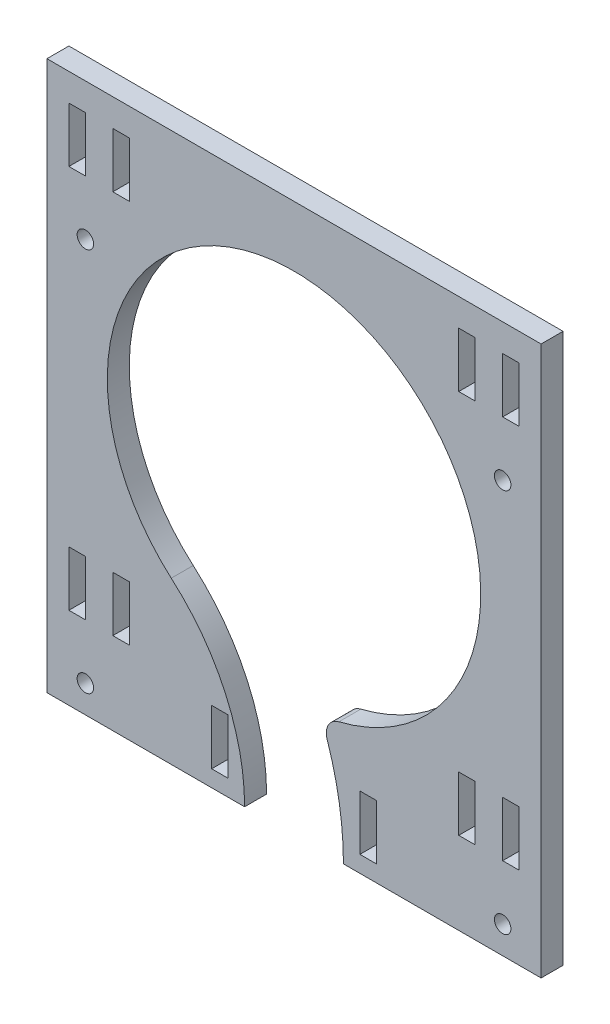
SolidWorks part; units mm, degrees
ref_plane "前视基准面" through (0, 0, 0) normal (0, 0, 1) x (1, 0, 0)
ref_plane "上视基准面" through (0, 0, 0) normal (0, 1, 0) x (1, 0, 0)
ref_plane "右视基准面" through (0, 0, 0) normal (1, 0, 0) x (0, 0, -1)
sketch "草图1" plane through (0, 0, 0) normal (0, 0, 1) x (1, 0, 0)
  line L0 (0, 0) -> (-23.7764, 7.7254) construction
  circle A0 centre (0, 0) radius 12.5
  circle A1 centre (0, 25) radius 12.5
  circle A2 centre (23.7764, 7.7254) radius 12.5
  circle A3 centre (14.6946, -20.2254) radius 12.5
  circle A4 centre (-14.6946, -20.2254) radius 12.5
  circle A5 centre (-23.7764, 7.7254) radius 12.5
  circle A6 centre (-23.7764, 7.7254) radius 10.5
  circle A7 centre (0, 25) radius 10.5
  circle A8 centre (23.7764, 7.7254) radius 10.5
  circle A9 centre (-14.6946, -20.2254) radius 10.5
  circle A10 centre (14.6946, -20.2254) radius 10.5
  circle A11 centre (-23.7764, 7.7254) radius 9
  circle A12 centre (0, 25) radius 9
  circle A13 centre (23.7764, 7.7254) radius 9
  circle A14 centre (14.6946, -20.2254) radius 9
  circle A15 centre (-14.6946, -20.2254) radius 9
  circle A17 centre (0, 0) radius 35.5
  point P16 (0, 0)
  dimension "D1" = 25
  dimension "D2" = 25
  dimension "D4" = 21
  dimension "D5" = 21
  dimension "D6" = 21
  dimension "D7" = 21
  dimension "D8" = 18
  dimension "D11" = 21
  dimension "D3" = 5
  dimension "D10" = 25
  dimension "D9" = 5
sketch "草图2" plane through (0, 0, 0) normal (0, 0, 1) x (1, 0, 0)
  line L0 (-10.5, 25) -> (-10.5, 27.9643)
  line L1 (10.5, 25) -> (10.5, 27.9643)
  line L2 (20.5317, 17.7115) -> (23.3509, 18.6275)
  line L3 (27.0211, -2.2607) -> (29.8403, -1.3447)
  line L4 (23.1893, -14.0537) -> (24.9317, -16.4518)
  line L5 (6.2, -26.3972) -> (7.9423, -28.7953)
  line L6 (-6.2, -26.3972) -> (-7.9423, -28.7953)
  line L7 (-23.1893, -14.0537) -> (-24.9317, -16.4518)
  line L8 (-27.0211, -2.2607) -> (-29.8403, -1.3447)
  line L9 (-20.5317, 17.7115) -> (-23.3509, 18.6275)
  line L11 (0, 0) -> (27.0211, -2.2607) construction
  circle A0 centre (14.6946, -20.2254) radius 10.5 construction
  circle A1 centre (-14.6946, -20.2254) radius 10.5 construction
  circle A2 centre (23.7764, 7.7254) radius 10.5 construction
  circle A3 centre (0, 25) radius 10.5 construction
  circle A4 centre (-23.7764, 7.7254) radius 10.5 construction
  circle A5 centre (0, 0) radius 35.5 construction
  arc A6 (23.1893, -14.0537) -> (6.2, -26.3972) centre (14.6946, -20.2254) ccw
  arc A7 (-6.2, -26.3972) -> (-23.1893, -14.0537) centre (-14.6946, -20.2254) ccw
  arc A8 (20.5317, 17.7115) -> (27.0211, -2.2607) centre (23.7764, 7.7254) ccw
  arc A9 (-10.5, 25) -> (10.5, 25) centre (0, 25) ccw
  arc A10 (-27.0211, -2.2607) -> (-20.5317, 17.7115) centre (-23.7764, 7.7254) ccw
  arc A11 (-16.3413, 31.5153) -> (-24.9231, 25.2802) centre (0, 0) ccw
  arc A12 (-35.0225, -5.8027) -> (-31.7446, -15.8912) centre (0, 0) ccw
  arc A13 (24.9231, 25.2802) -> (16.3413, 31.5153) centre (0, 0) ccw
  arc A14 (31.7446, -15.8912) -> (35.0225, -5.8027) centre (0, 0) ccw
  arc A15 (-5.3039, -35.1016) -> (5.3039, -35.1016) centre (0, 0) ccw
  arc A16 (23.3509, 18.6275) -> (24.9231, 25.2802) centre (22.1148, 22.4318) ccw
  arc A17 (10.5, 27.9643) -> (16.3413, 31.5153) centre (14.5, 27.9643) cw
  arc A18 (-10.5, 27.9643) -> (-16.3413, 31.5153) centre (-14.5, 27.9643) ccw
  arc A19 (-23.3509, 18.6275) -> (-24.9231, 25.2802) centre (-22.1148, 22.4318) cw
  arc A20 (24.9317, -16.4518) -> (31.7446, -15.8912) centre (28.1677, -14.1007) ccw
  arc A21 (7.9423, -28.7953) -> (5.3039, -35.1016) centre (4.7062, -31.1465) cw
  arc A22 (-7.9423, -28.7953) -> (-5.3039, -35.1016) centre (-4.7062, -31.1465) ccw
  arc A23 (-24.9317, -16.4518) -> (-31.7446, -15.8912) centre (-28.1677, -14.1007) cw
  arc A24 (-35.0225, -5.8027) -> (-29.8403, -1.3447) centre (-31.0763, -5.1489) cw
  arc A25 (29.8403, -1.3447) -> (35.0225, -5.8027) centre (31.0763, -5.1489) cw
  dimension "D2" = 4
  dimension "D3" = 4
  dimension "D1" = 5
sketch "草图3" plane through (0, 0, 0) normal (0, 0, 1) x (1, 0, 0)
  line L0 (-45, 45) -> (45, 45)
  line L1 (45, 45) -> (45, -45)
  line L3 (-45, -45) -> (-45, 45)
  line L4 (-45, -45) -> (-45, -55)
  line L8 (45, -45) -> (45, -55)
  line L9 (9, -55) -> (45, -55)
  line L10 (-45, -55) -> (-9, -55)
  arc A15 (4.8514, -33.6521) -> (-22.3562, -25.6164) centre (0, 0) ccw
  arc A26 (-9, -55) -> (-22.3562, -25.6164) centre (-48, -55) ccw
  arc A28 (9, -55) -> (4.8514, -33.6521) centre (-48, -55) ccw
  dimension "D1" = 90
  dimension "D2" = 90
  dimension "D3" = 10
extrude "凸台-拉伸2" add sketch "草图3" along normal blind 4
sketch "草图4" plane through (0, 0, 4) normal (0, 0, 1) x (1, 0, 0)
  circle A0 centre (0, 0) radius 13.5
sketch "草图5" plane through (0, 0, 4) normal (0, 0, 1) x (1, 0, 0)
  line L0 (-33, 40) -> (-33, 30)
  line L1 (-33, 30) -> (-30, 30)
  line L2 (-30, 30) -> (-30, 40)
  line L3 (-30, 40) -> (-33, 40)
  line L4 (30, 40) -> (30, 30)
  line L5 (30, 30) -> (33, 30)
  line L6 (33, 30) -> (33, 40)
  line L7 (33, 40) -> (30, 40)
  line L8 (-33, -30) -> (-33, -40)
  line L9 (-33, -40) -> (-30, -40)
  line L10 (-30, -40) -> (-30, -30)
  line L11 (-30, -30) -> (-33, -30)
  line L12 (30, -30) -> (30, -40)
  line L13 (30, -40) -> (33, -40)
  line L14 (33, -40) -> (33, -30)
  line L15 (33, -30) -> (30, -30)
  line L16 (0, 45) -> (0, -54.353) construction
  line L17 (-45, 45) -> (45, 45) construction
  line L18 (-45, 0) -> (45, 0) construction
  line L19 (-45, -55) -> (-45, 45) construction
  line L20 (45, -55) -> (45, 45) construction
  dimension "D1" = 3
  dimension "D2" = 10
  dimension "D3" = 10
  dimension "D4" = 3
  dimension "D5" = 10
  dimension "D6" = 3
  dimension "D7" = 3
  dimension "D8" = 10
  dimension "D9" = 30
  dimension "D10" = 30
  dimension "D11" = 30
  dimension "D12" = 30
  dimension "D13" = 30
  dimension "D14" = 30
  dimension "D15" = 30
  dimension "D16" = 30
extrude "切除-拉伸2" cut sketch "草图5" against normal through all
sketch "草图6" plane through (0, 0, 4) normal (0, 0, 1) x (1, 0, 0)
  line L0 (-38, -30) -> (-38, -40)
  line L1 (-38, -40) -> (-41, -40)
  line L2 (-41, -40) -> (-41, -30)
  line L3 (-41, -30) -> (-38, -30)
  line L4 (-33, -30) -> (-33, -40) construction
  line L5 (-30, -30) -> (-33, -30) construction
  line L6 (-41, 40) -> (-41, 30)
  line L7 (-41, 30) -> (-38, 30)
  line L8 (-38, 30) -> (-38, 40)
  line L9 (-38, 40) -> (-41, 40)
  line L11 (-45, 45) -> (45, 45) construction
  line L12 (-45, -55) -> (-9, -55) construction
  line L16 (-15, -42) -> (-15, -52)
  line L17 (-15, -52) -> (-12, -52)
  line L18 (-12, -52) -> (-12, -42)
  line L19 (-15, -42) -> (-12, -42)
  line L20 (0, 45) -> (0, -55.2023) construction
  line L21 (15, -42) -> (12, -42)
  line L22 (12, -52) -> (12, -42)
  line L23 (15, -52) -> (12, -52)
  line L24 (15, -42) -> (15, -52)
  line L25 (38, 40) -> (41, 40)
  line L26 (38, 30) -> (38, 40)
  line L27 (41, 30) -> (38, 30)
  line L28 (41, 40) -> (41, 30)
  line L29 (41, -30) -> (38, -30)
  line L30 (41, -40) -> (41, -30)
  line L31 (38, -40) -> (41, -40)
  line L32 (38, -30) -> (38, -40)
  circle A0 centre (-38, -50) radius 1.5
  circle A1 centre (-38, 20) radius 1.5
  circle A2 centre (38, 20) radius 1.5
  circle A3 centre (38, -50) radius 1.5
  dimension "D7" = 25
  dimension "D8" = 3
  dimension "D9" = 3
  dimension "D10" = 5
  dimension "D1" = 5
  dimension "D2" = 3
  dimension "D3" = 10
  dimension "D4" = 10
  dimension "D5" = 5
  dimension "D6" = 3
  dimension "D11" = 3
  dimension "D12" = 10
  dimension "D13" = 3
  dimension "D14" = 12
extrude "切除-拉伸3" cut sketch "草图6" against normal blind 10
fillet "圆角1" radius 3 1 edges at (4.8514, -33.6521, 2)
